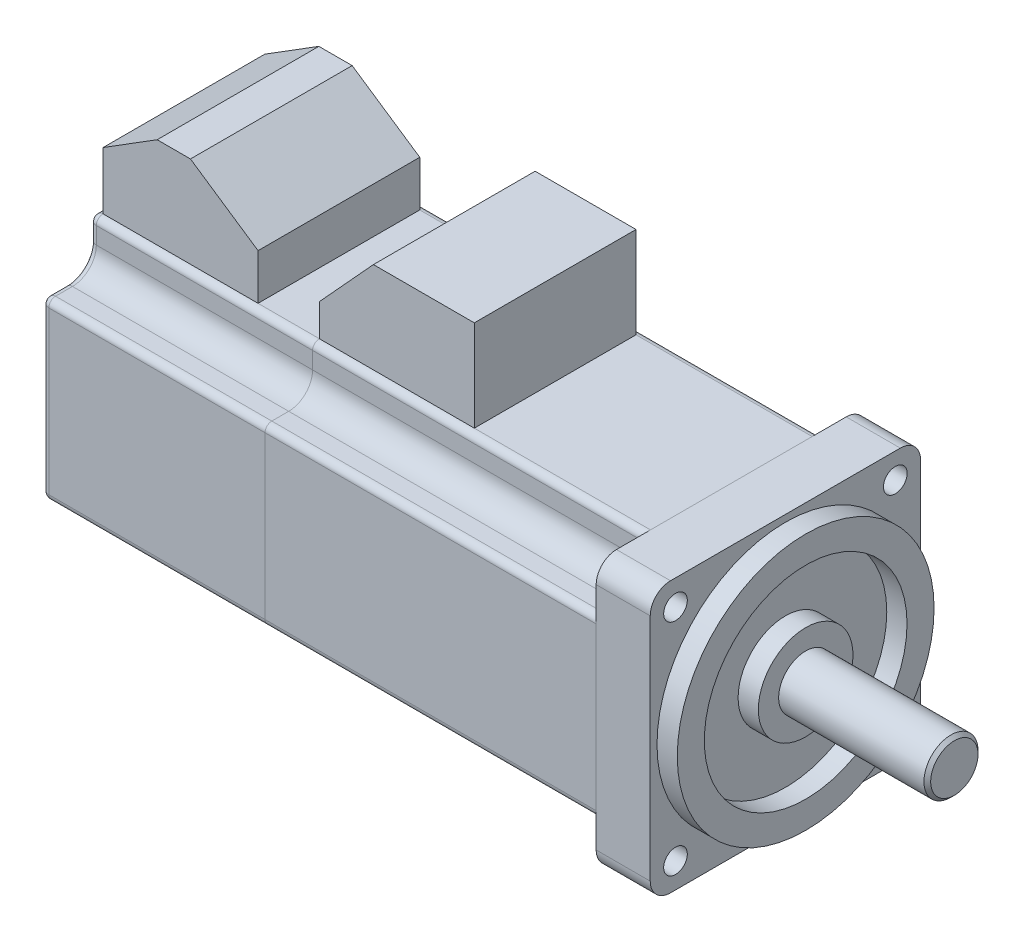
SolidWorks part; units mm, degrees
ref_plane "前视基准面" through (0, 0, 0) normal (0, 0, 1) x (1, 0, 0)
ref_plane "上视基准面" through (0, 0, 0) normal (0, 1, 0) x (1, 0, 0)
ref_plane "右视基准面" through (0, 0, 0) normal (1, 0, 0) x (0, 0, -1)
sketch "草图1" plane through (0, 0, 0) normal (1, 0, 0) x (0, 0, -1)
  line L1 (-17, -20) -> (17, -20)
  line L2 (-20, -17) -> (-20, 17)
  line L3 (-17, 20) -> (17, 20)
  line L4 (20, -17) -> (20, 17)
  line L5 (-20, -20) -> (20, 20) construction
  line L6 (-20, 20) -> (20, -20) construction
  arc A0 (-20, 17) -> (-17, 20) centre (-17, 17) cw
  arc A1 (-17, -20) -> (-20, -17) centre (-17, -17) cw
  arc A2 (17, -20) -> (20, -17) centre (17, -17) ccw
  arc A3 (17, 20) -> (20, 17) centre (17, 17) cw
  point P0 (0, 0)
  dimension "D1" = 3
extrude "凸台-拉伸1" add sketch "草图1" along normal blind 33
sketch "草图2" plane through (33, 0, 0) normal (1, 0, 0) x (0, 0, -1)
  line L0 (17, 20) -> (-17, 20) construction
  line L1 (-17, -20) -> (17, -20)
  line L2 (-20, -17) -> (-20, 17)
  line L3 (-17, 20) -> (17, 20)
  line L4 (20, -17) -> (20, 17)
  line L5 (-20, -20) -> (20, 20) construction
  line L6 (-20, 20) -> (20, -20) construction
  arc A0 (17, 20) -> (20, 17) centre (17, 17) cw
  arc A1 (17, -20) -> (20, -17) centre (17, -17) ccw
  arc A2 (-17, -20) -> (-20, -17) centre (-17, -17) cw
  arc A3 (-20, 17) -> (-17, 20) centre (-17, 17) cw
  point P0 (0, 0)
  dimension "D1" = 3
extrude "凸台-拉伸2" add sketch "草图2" along normal blind 49 separate body
sketch "草图3" plane through (82, 0, 0) normal (1, 0, 0) x (0, 0, -1)
  line L0 (17, 20) -> (-17, 20) construction
  line L1 (-17, -20) -> (17, -20)
  line L2 (-20, -17) -> (-20, 17)
  line L3 (-17, 20) -> (17, 20)
  line L4 (20, -17) -> (20, 17)
  line L5 (-20, -20) -> (20, 20) construction
  line L6 (-20, 20) -> (20, -20) construction
  arc A0 (17, 20) -> (20, 17) centre (17, 17) cw
  arc A1 (17, -20) -> (20, -17) centre (17, -17) ccw
  arc A2 (-17, -20) -> (-20, -17) centre (-17, -17) cw
  arc A3 (-20, 17) -> (-17, 20) centre (-17, 17) cw
  point P0 (0, 0)
  dimension "D1" = 3
extrude "凸台-拉伸3" add sketch "草图3" along normal blind 8 separate body
sketch "草图4" plane through (0, 0, 0) normal (-1, 0, 0) x (0, 0, 1)
  line L0 (-16.5, 12.9645) -> (-19, 12.9645)
  line L1 (-20, 11.9645) -> (-20, 17)
  line L3 (-17, 20) -> (-11.9645, 20)
  line L4 (11.9645, 20) -> (17, 20)
  line L6 (20, 17) -> (20, 11.9645)
  line L7 (-20, -17) -> (-20, 17) construction
  line L8 (20, -11.9645) -> (20, -17)
  line L9 (-19, -12.9645) -> (-16.5, -12.9645)
  line L11 (-12.9645, -16.5) -> (-12.9645, -19)
  line L12 (17, -20) -> (-17, -20) construction
  line L13 (17, -20) -> (11.9645, -20)
  line L14 (12.9645, -19) -> (12.9645, -16.5)
  line L15 (-11.9645, -20) -> (-17, -20)
  line L16 (16.5, -12.9645) -> (19, -12.9645)
  line L17 (20, 17) -> (20, -17) construction
  line L19 (19, 12.9645) -> (16.5, 12.9645)
  line L20 (-20, -17) -> (-20, -11.9645)
  line L21 (12.9645, 16.5) -> (12.9645, 19)
  line L22 (-17, 20) -> (17, 20) construction
  line L24 (-12.9645, 19) -> (-12.9645, 16.5)
  arc A0 (-16.5, 12.9645) -> (-12.9645, 16.5) centre (-16.5, 16.5) ccw
  arc A1 (12.9645, 16.5) -> (16.5, 12.9645) centre (16.5, 16.5) ccw
  arc A2 (16.5, -12.9645) -> (12.9645, -16.5) centre (16.5, -16.5) ccw
  arc A3 (-12.9645, -16.5) -> (-16.5, -12.9645) centre (-16.5, -16.5) ccw
  arc A4 (-11.9645, 20) -> (-12.9645, 19) centre (-11.9645, 19) ccw
  arc A5 (12.9645, 19) -> (11.9645, 20) centre (11.9645, 19) ccw
  arc A6 (20, 11.9645) -> (19, 12.9645) centre (19, 11.9645) ccw
  arc A7 (19, -12.9645) -> (20, -11.9645) centre (19, -11.9645) ccw
  arc A8 (11.9645, -20) -> (12.9645, -19) centre (11.9645, -19) ccw
  arc A9 (-12.9645, -19) -> (-11.9645, -20) centre (-11.9645, -19) ccw
  arc A10 (-19, 12.9645) -> (-20, 11.9645) centre (-19, 11.9645) ccw
  arc A11 (-20, -11.9645) -> (-19, -12.9645) centre (-19, -11.9645) ccw
  arc A12 (-20, -17) -> (-17, -20) centre (-17, -17) ccw
  arc A13 (17, -20) -> (20, -17) centre (17, -17) ccw
  arc A14 (20, 17) -> (17, 20) centre (17, 17) ccw
  arc A15 (-17, 20) -> (-20, 17) centre (-17, 17) ccw
  point P0 (0, 0)
  point P10 (-12.9645, 20)
  point P39 (12.9645, 20)
  point P42 (20, 12.9645)
  point P45 (20, -12.9645)
  point P48 (12.9645, -20)
  point P51 (-12.9645, -20)
  point P54 (-20, 12.9645)
  point P57 (-20, -12.9645)
  dimension "D1" = 1
extrude "切除-拉伸1" cut sketch "草图4" against normal blind 82
sketch "草图5" plane through (90, 0, 0) normal (1, 0, 0) x (0, 0, -1)
  circle A2 centre (-16.2635, 16.2635) radius 1.75
  circle A3 centre (16.2635, 16.2635) radius 1.75
  circle A4 centre (16.2635, -16.2635) radius 1.75
  circle A5 centre (-16.2635, -16.2635) radius 1.75
extrude "切除-拉伸2" cut sketch "草图5" against normal blind 8
fillet "圆角1" radius 1 24 edges at (0, 20, 0) (0, 19.7071, 12.6716) (0, 17.75, 12.9645) (0, 14, 14) (0, 12.9645, 17.75) (0, 12.6716, 19.7071) (0, 0, 20) (0, -12.6716, 19.7071) (0, -12.9645, 17.75) (0, -14, 14) (0, -17.75, 12.9645) (0, -19.7071, 12.6716) (0, -20, 0) (0, -19.7071, -12.6716) (0, -17.75, -12.9645) (0, -14, -14) (0, -12.9645, -17.75) (0, -12.6716, -19.7071) (0, 0, -20) (0, 12.6716, -19.7071) (0, 12.9645, -17.75) (0, 14, -14) (0, 17.75, -12.9645) (0, 19.7071, -12.6716)
sketch "草图6" plane through (90, 0, 0) normal (1, 0, 0) x (0, 0, -1)
  circle A0 centre (0, 0) radius 19
  circle A1 centre (0, 0) radius 15
  circle A2 centre (0, 0) radius 7
extrude "凸台-拉伸4" add sketch "草图6" along normal blind 3 contours A0 A1 | A2
sketch "草图7" plane through (93, 0, 0) normal (1, 0, 0) x (0, 0, -1)
  circle A0 centre (0, 0) radius 4
extrude "凸台-拉伸5" add sketch "草图7" along normal blind 22 separate body
chamfer "倒角1" distance 0.5 angle 45 1 edges at (115, 0, -4)
sketch "草图12" plane through (0, 20, 0) normal (0, 1, 0) x (1, 0, 0)
  line L0 (33, 11.9645) -> (55.93, 11.9645)
  line L1 (1, 11.9645) -> (23.93, 11.9645)
  line L2 (33, 11.9645) -> (1, 11.9645) construction
  line L3 (23.93, -11.9645) -> (1, -11.9645)
  line L4 (33, -11.9645) -> (1, -11.9645) construction
  line L5 (23.93, 11.9645) -> (23.93, -11.9645)
  line L6 (1, 11.9645) -> (1, -11.9645)
  line L7 (82, 11.9645) -> (33, 11.9645) construction
  line L8 (55.93, 11.9645) -> (55.93, -11.9645)
  line L9 (82, -11.9645) -> (33, -11.9645) construction
  line L10 (55.93, -11.9645) -> (33, -11.9645)
  line L11 (33, -11.9645) -> (33, 11.9645)
extrude "凸台-拉伸6" add sketch "草图12" along normal blind 13.5 separate body
sketch "草图13" plane through (0, 0, 11.9645) normal (0, 0, 1) x (1, 0, 0)
  line L0 (1, 33.5) -> (1, 28.5)
  line L1 (1, 33.5) -> (9, 33.5)
  line L2 (1, 33.5) -> (23.93, 33.5) construction
  line L3 (23.93, 33.5) -> (13.93, 33.5)
  line L4 (23.93, 33.5) -> (23.93, 26.75)
  line L5 (23.93, 33.5) -> (23.93, 20) construction
  line L6 (23.93, 26.75) -> (13.93, 33.5)
  line L7 (33, 33.5) -> (41, 33.5)
  line L8 (33, 33.5) -> (55.93, 33.5) construction
  line L9 (33, 33.5) -> (33, 24.7508)
  line L10 (33, 33.5) -> (33, 20) construction
  line L11 (33, 24.7508) -> (41, 33.5)
  line L12 (9, 33.5) -> (1, 28.5)
extrude "切除-拉伸3" cut sketch "草图13" against normal blind 23.93
